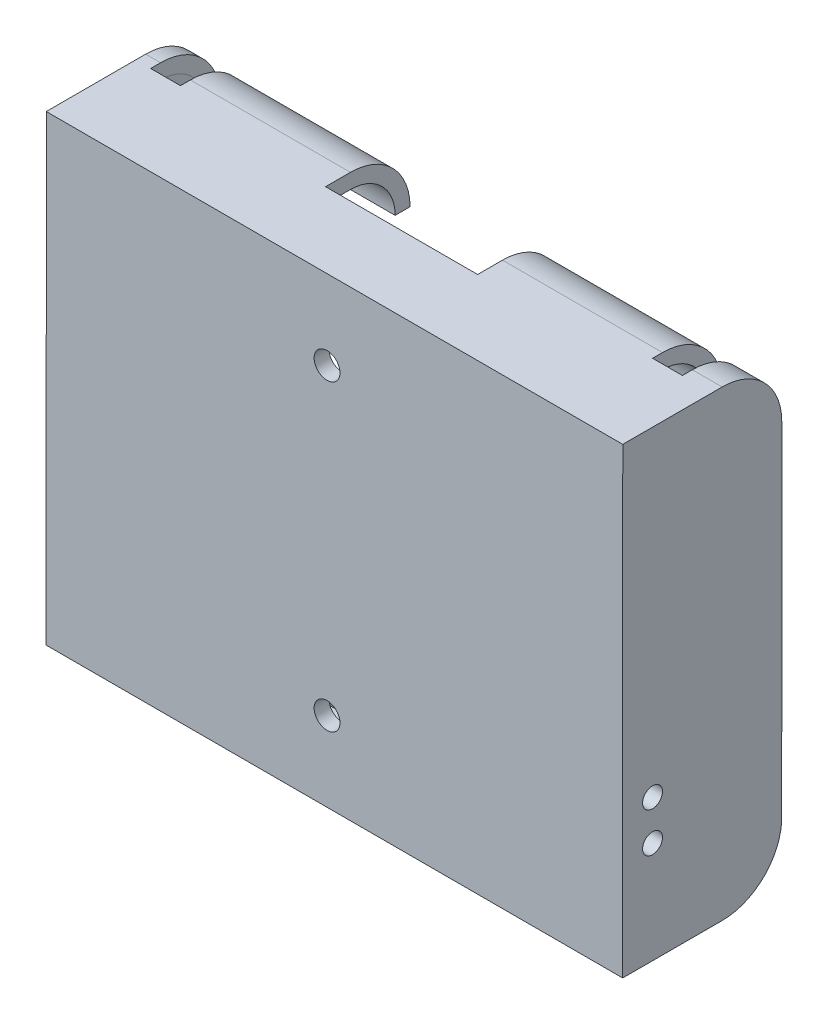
SolidWorks part; units mm, degrees
ref_plane "Face" through (0, 0, 0) normal (0, 0, 1) x (1, 0, 0)
ref_plane "Dessus" through (0, 0, 0) normal (0, 1, 0) x (1, 0, 0)
ref_plane "Droite" through (0, 0, 0) normal (1, 0, 0) x (0, 0, -1)
sketch "Esquisse1" plane through (0, 0, 0) normal (0, 0, 1) x (1, 0, 0)
  line L0 (-28.25, 36.4313) -> (-28.25, -47.0804) construction
  line L1 (29.7454, 39.9313) -> (29.7454, -43.5804) construction
  line L2 (-42.1759, -12.25) -> (43.858, -12.25) construction
  line L5 (-28.25, 34.25) -> (29.75, 34.25)
  line L6 (-28.25, 34.25) -> (-28.2546, -12.25)
  line L7 (-28.2546, -12.25) -> (29.7454, -12.25)
  line L8 (29.75, 34.25) -> (29.7454, -12.25)
  dimension "D2" = 58
  dimension "D3" = 46.5
extrude "Base-Extrusion" add sketch "Esquisse1" against normal blind 16
fillet "Congé1" radius 6 2 edges at (0.75, 34.25, -16) (0.7454, -12.25, -16)
shell "Coque1" thickness 1.5
sketch "Esquisse3" plane through (0, 34.25, 0) normal (0, 1, 0) x (-1, 0, 0)
  line L0 (29.248, -9) -> (-31.6408, -9) construction
  line L1 (26.75, -2.27) -> (26.75, -22.4823) construction
  line L2 (-26.75, -2.27) -> (-26.75, -20.7193) construction
  line L3 (12.4989, -7.5) -> (-13.5693, -7.5) construction
  line L4 (0, -0.5699) -> (0, -21.8527) construction
  line L5 (23.75, -7.5) -> (23.75, -19.2081) construction
  line L6 (7.65, -19.2081) -> (7.65, -4.6628) construction
  line L7 (-7.65, -19.2081) -> (-7.65, -4.159) construction
  line L8 (-26.75, -19.2081) -> (-23.75, -19.2081)
  line L9 (26.75, -9) -> (23.75, -9)
  line L10 (26.75, -9) -> (26.75, -19.2081)
  line L11 (26.75, -19.2081) -> (23.75, -19.2081)
  line L12 (23.75, -9) -> (23.75, -19.2081)
  line L13 (7.65, -7.5) -> (-7.65, -7.5)
  line L14 (7.65, -7.5) -> (7.65, -18.3265)
  line L15 (7.65, -18.3265) -> (-7.65, -18.3265)
  line L16 (-7.65, -7.5) -> (-7.65, -18.3265)
  line L17 (-26.75, -9) -> (-26.75, -19.2081)
  line L18 (-26.75, -9) -> (-23.75, -9)
  line L19 (-23.75, -9) -> (-23.75, -19.2081)
extrude "Enlèv. mat.-Extru.2" cut sketch "Esquisse3" against normal through all
sketch "Esquisse4" plane through (29.7466, -0.0029, 0) normal (1, -0.0001, 0) x (0, 0, -1)
  line L0 (-1.5631, 0) -> (18.4717, 0) construction
  line L1 (-1.5631, -2) -> (17.0634, -2) construction
  line L2 (-1.5631, 2) -> (19.7892, 2) construction
  line L3 (3, 3.8616) -> (3, -2.9984) construction
  circle A0 centre (3, 2) radius 1
  circle A1 centre (3, -2) radius 1
extrude "Enlèv. mat.-Extru.3" cut sketch "Esquisse4" against normal blind 6
sketch "Esquisse5" plane through (-41.166, -21.1238, -1.5) normal (0, 0, -1) x (-1, 0, 0)
  line L0 (-69.4137, 32.1238) -> (0, 32.1238) construction
  line L3 (-41.166, 53.8738) -> (-41.166, 0) construction
  line L4 (-33.516, 53.8738) -> (-48.816, 53.8738) construction
  line L5 (-69.412, 14.8738) -> (-69.4154, 49.3738) construction
  circle A0 centre (-41.166, 47.3738) radius 1.3
  circle A1 centre (-41.166, 16.8738) radius 1.3
  dimension "D1" = 2.6
  dimension "D2" = 30.5
extrude "Enlèv. mat.-Extru.4" cut sketch "Esquisse5" against normal through all
